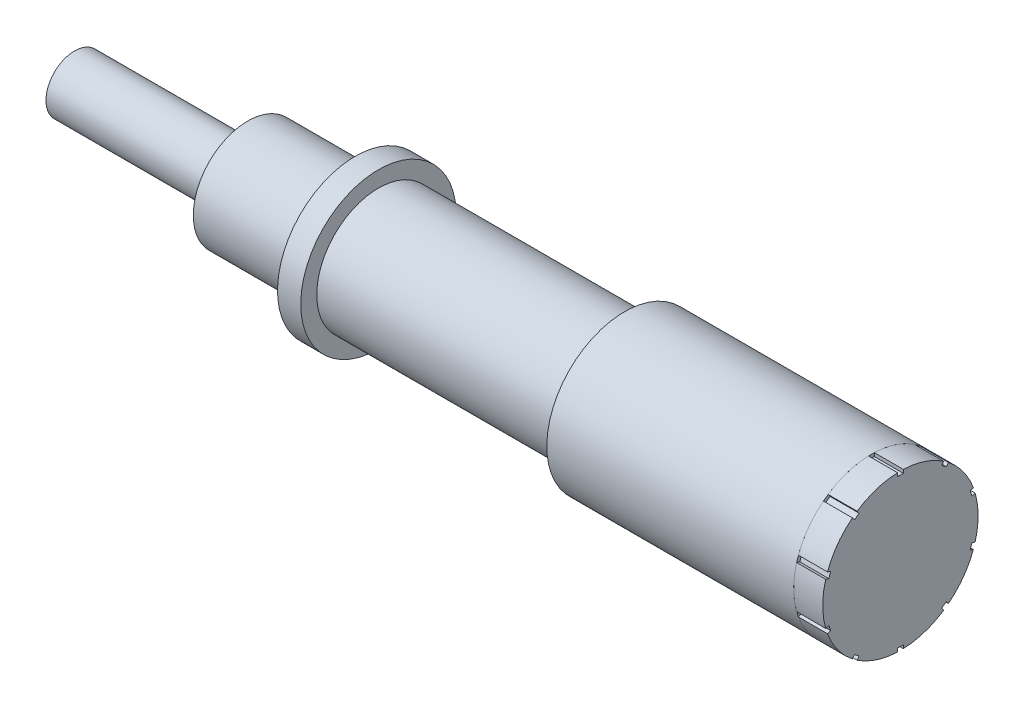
SolidWorks part; units mm, degrees
ref_plane "Front Plane" through (0, 0, 0) normal (0, 0, 1) x (1, 0, 0)
ref_plane "Top Plane" through (0, 0, 0) normal (0, 1, 0) x (1, 0, 0)
ref_plane "Right Plane" through (0, 0, 0) normal (1, 0, 0) x (0, 0, -1)
sketch "Sketch1" plane through (0, 0, 0) normal (0, 0, 1) x (1, 0, 0)
  line L0 (-8.7906, 0) -> (60.8838, 0) construction
  line L1 (60.8838, 0) -> (60.8838, 6.7945)
  line L2 (60.8838, 6.7945) -> (39.2965, 6.7945)
  line L3 (39.2965, 6.7945) -> (39.2965, 5.3975)
  line L4 (39.2965, 5.3975) -> (17.78, 5.3975)
  line L5 (17.78, 5.3975) -> (17.78, 6.7945)
  line L6 (17.78, 6.7945) -> (15.748, 6.7945)
  line L7 (15.748, 6.7945) -> (15.748, 4.7625)
  line L8 (15.748, 4.7625) -> (6.35, 4.7625)
  line L9 (6.35, 4.7625) -> (6.35, 2.5019)
  line L10 (6.35, 2.5019) -> (-8.7906, 2.5019)
  line L11 (-8.7906, 2.5019) -> (-8.7906, 0)
  line L12 (-8.7906, 0) -> (60.8838, 0)
  line L14 (-8.7906, -4.0991) -> (-8.7906, 3.4344) construction
  dimension "D1" = 2.5019
  dimension "D3" = 9.398
  dimension "D4" = 4.7625
  dimension "D5" = 2.032
  dimension "D6" = 6.7945
  dimension "D7" = 21.5165
revolve "Revolve1" add sketch "Sketch1" angle 360 about L0
move or copy body "Body-Move/Copy1" [suppressed] bodies to move or copy 101 copy no translate (-12.7, 0, 0)
sketch "Sketch4" plane through (60.8838, 0, 0) normal (1, 0, 0) x (0, 0, -1)
  circle A0 centre (0, 0) radius 6.7945
extrude "Boss-Extrude1" add sketch "Sketch4" along normal blind 2.54 separate body
sketch "Sketch5" plane through (63.4238, 0, 0) normal (1, 0, 0) x (0, 0, -1)
  line L1 (-0.254, 6.493) -> (0.254, 6.493)
  line L2 (-0.254, 6.493) -> (-0.254, 6.9449)
  line L3 (-0.254, 6.9449) -> (0.254, 6.9449)
  line L4 (0.254, 6.493) -> (0.254, 6.9449)
extrude "Cut-Extrude1" cut sketch "Sketch5" against normal blind 2.54
pattern_circular "CirPattern1" count 10 over 360 about axis through (0, 0, 0) along (1, 0, 0) of "Cut-Extrude1"
